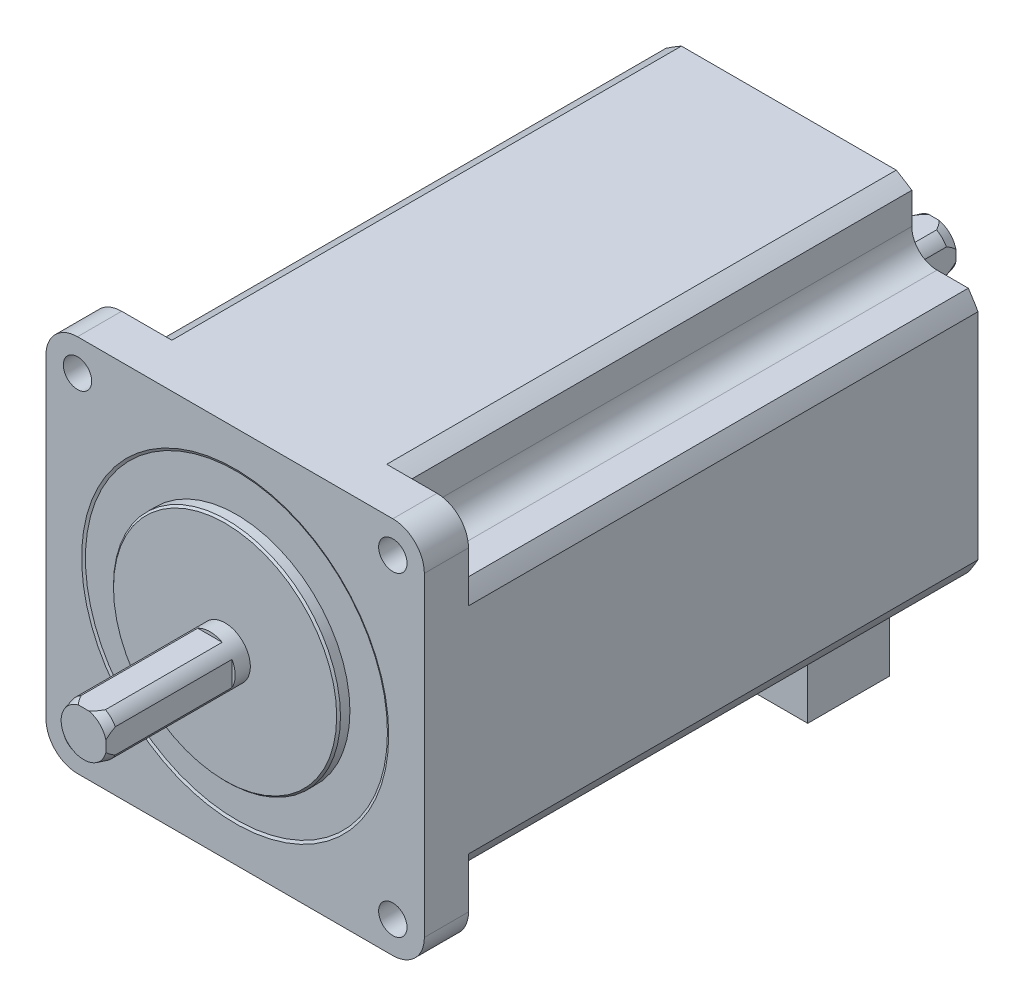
SolidWorks part; units mm, degrees
ref_plane "正面" through (0, 0, 0) normal (0, 0, 1) x (1, 0, 0)
ref_plane "平面" through (0, 0, 0) normal (0, 1, 0) x (1, 0, 0)
ref_plane "右側面" through (0, 0, 0) normal (1, 0, 0) x (0, 0, -1)
sketch "ｽｹｯﾁ1" plane through (0, 0, 0) normal (0, 0, 1) x (1, 0, 0)
  circle A0 centre (0, 0) radius 4
  dimension "D1" = 8
extrude "押し出し1" add sketch "ｽｹｯﾁ1" along normal blind 22.4
sketch "ｽｹｯﾁ2" plane through (0, 0, 0) normal (0, 0, -1) x (-1, 0, 0)
  circle A0 centre (0, 0) radius 18
  dimension "D1" = 36
extrude "押し出し2" add sketch "ｽｹｯﾁ2" along normal blind 1.6
sketch "ｽｹｯﾁ3" plane through (0, 0, -1.6) normal (0, 0, -1) x (-1, 0, 0)
  line L1 (-30, 30) -> (30, 30)
  line L2 (-30, 30) -> (-30, -30)
  line L3 (-30, -30) -> (30, -30)
  line L4 (30, 30) -> (30, -30)
  line L5 (-30, 30) -> (30, -30) construction
  line L6 (-30, -30) -> (30, 30) construction
  line L7 (25, 25) -> (-25, 25) construction
  line L8 (25, 25) -> (25, -25) construction
  line L9 (25, -25) -> (-25, -25) construction
  line L10 (-25, 25) -> (-25, -25) construction
  line L11 (25, 25) -> (-25, -25) construction
  line L12 (25, -25) -> (-25, 25) construction
  circle A0 centre (25, 25) radius 2.25
  circle A1 centre (-25, 25) radius 2.25
  circle A2 centre (25, -25) radius 2.25
  circle A3 centre (-25, -25) radius 2.25
  point P0 (0, 0)
  point P6 (0, 0)
  dimension "D3" = 50
  dimension "D4" = 50
  dimension "D6" = 4.5
  dimension "D1" = 60
  dimension "D2" = 60
extrude "押し出し3" add sketch "ｽｹｯﾁ3" along normal blind 7
fillet "Fillet1" radius 5 4 edges at (30, -30, -5.1) (-30, -30, -5.1) (-30, 30, -5.1) (30, 30, -5.1)
sketch "ｽｹｯﾁ4" plane through (0, 0, -8.6) normal (0, 0, -1) x (-1, 0, 0)
  line L0 (19.5, 19.5) -> (30, 19.5)
  line L1 (-19.5, 30) -> (19.5, 30)
  line L2 (-19.5, 30) -> (-19.5, 19.5)
  line L3 (-19.5, -30) -> (19.5, -30)
  line L4 (19.5, 30) -> (19.5, 19.5)
  line L5 (-19.5, 30) -> (19.5, -30) construction
  line L6 (-19.5, -30) -> (19.5, 30) construction
  line L7 (-30, 19.5) -> (-19.5, 19.5)
  line L8 (-30, 19.5) -> (-30, -19.5)
  line L9 (-30, -19.5) -> (-19.5, -19.5)
  line L10 (30, 19.5) -> (30, -19.5)
  line L11 (-30, 19.5) -> (30, -19.5) construction
  line L12 (-30, -19.5) -> (30, 19.5) construction
  line L13 (-19.5, -19.5) -> (-19.5, -30)
  line L14 (19.5, -19.5) -> (30, -19.5)
  line L15 (19.5, -19.5) -> (19.5, -30)
  circle A0 centre (0, 0) radius 34.5
  point P0 (0, 0)
  point P6 (0, 0)
  dimension "D5" = 69
  dimension "D1" = 39
  dimension "D2" = 60
  dimension "D3" = 60
  dimension "D4" = 39
extrude "押し出し4" add sketch "ｽｹｯﾁ4" along normal blind 80.8 contours L10 A0 L0 L4 L1 L2 L7 L8 L9 L13 L3 L15 L14
fillet "Fillet2" radius 4 4 edges at (19.5, -19.5, -49) (-19.5, -19.5, -49) (-19.5, 19.5, -49) (19.5, 19.5, -49)
sketch "Sketch1" plane through (0, -30, 0) normal (0, -1, 0) x (1, 0, 0)
  line L0 (17.0367, -89.4) -> (-17.0367, -89.4) construction
  line L1 (-16, -89.4) -> (16, -89.4)
  line L2 (-16, -89.4) -> (-16, -76.4)
  line L3 (-16, -76.4) -> (16, -76.4)
  line L4 (16, -89.4) -> (16, -76.4)
  dimension "D1" = 13
  dimension "D2" = 32
  dimension "D3" = 16
extrude "Extrude1" add sketch "Sketch1" along normal blind 10
chamfer "Chamfer1" distance 1.5 angle 15 1 edges at (4, 0, 22.4)
sketch "Sketch2" plane through (0, 0, 22.4) normal (0, 0, 1) x (1, 0, 0)
  line L1 (-4.7278, 5.1185) -> (3.4221, 5.1185)
  line L2 (-4.7278, 5.1185) -> (-4.7278, 3.5)
  line L3 (-4.7278, 3.5) -> (3.4221, 3.5)
  line L4 (3.4221, 5.1185) -> (3.4221, 3.5)
  line L5 (5.2412, 2.4413) -> (3.5, 2.4413)
  line L6 (5.2412, 2.4413) -> (5.2412, -4.2883)
  line L7 (5.2412, -4.2883) -> (3.5, -4.2883)
  line L8 (3.5, 2.4413) -> (3.5, -4.2883)
  dimension "D1" = 3.5
  dimension "D2" = 3.5
extrude "Extrude2" cut sketch "Sketch2" against normal blind 20
chamfer "Chamfer2" distance 0.3 angle 45 1 edges at (-18, 0, 0)
sketch "Sketch3" plane through (0, 0, -1.6) normal (0, 0, 1) x (1, 0, 0)
  circle A0 centre (0, 0) radius 18
  circle A1 centre (0, 0) radius 24.35
  dimension "D1" = 48.7
  dimension "D2" = 36
extrude "Extrude3" cut sketch "Sketch3" against normal blind 0.2
chamfer "Chamfer3" distance 0.2 distance2 0.4 1 edges at (24.35, 0, -1.8)
sketch "Sketch4" plane through (0, 0, -89.4) normal (0, 0, -1) x (-1, 0, 0)
  circle A0 centre (0, 0) radius 4
  dimension "D1" = 8
extrude "Extrude4" add sketch "Sketch4" along normal blind 23
sketch "Sketch5" plane through (0, 0, -112.4) normal (0, 0, -1) x (-1, 0, 0)
  line L1 (-2.9986, 5.5143) -> (3.3195, 5.5143)
  line L2 (-2.9986, 5.5143) -> (-2.9986, 3.5)
  line L3 (-2.9986, 3.5) -> (3.3195, 3.5)
  line L4 (3.3195, 5.5143) -> (3.3195, 3.5)
  line L5 (-5.554, 2.808) -> (-3.5, 2.808)
  line L6 (-5.554, 2.808) -> (-5.554, -3.231)
  line L7 (-5.554, -3.231) -> (-3.5, -3.231)
  line L8 (-3.5, 2.808) -> (-3.5, -3.231)
  dimension "D1" = 3.5
  dimension "D2" = 3.5
extrude "Extrude5" cut sketch "Sketch5" against normal blind 20
chamfer "Chamfer4" distance 1.5 angle 15 2 edges at (-2.8284, -2.8284, -112.4) (2.8284, 2.8284, -112.4)
